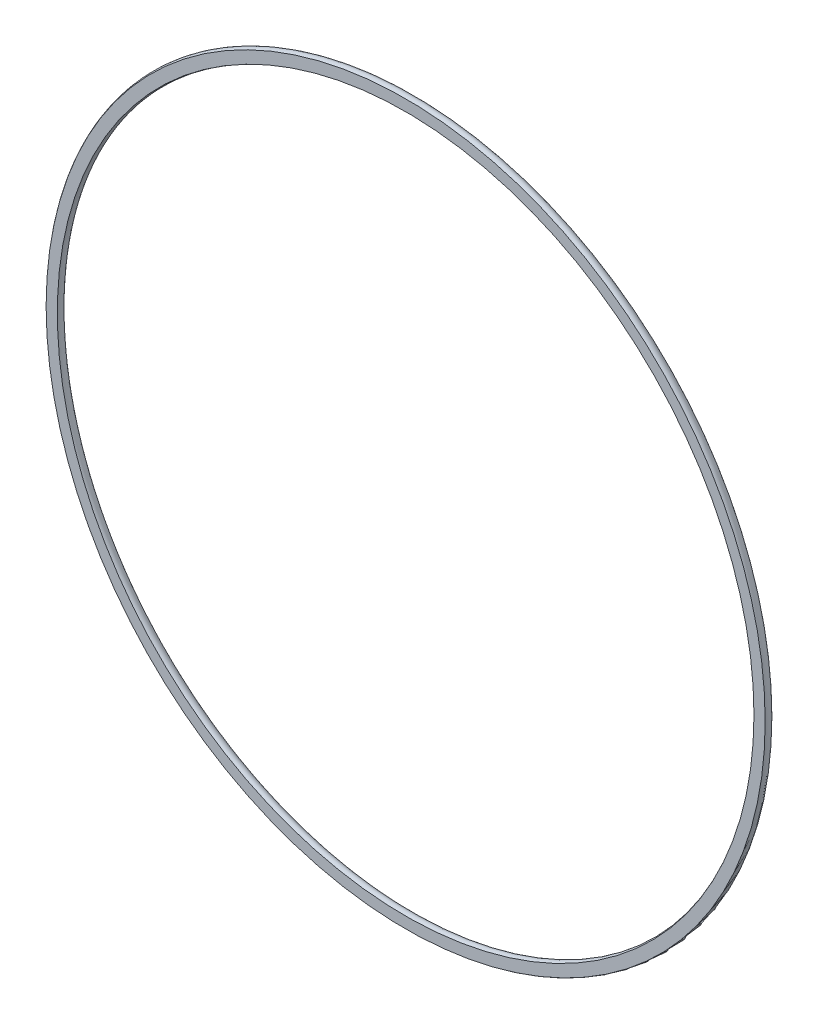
SolidWorks part; units mm, degrees
ref_plane "Front" through (0, 0, 0) normal (0, 0, 1) x (1, 0, 0)
ref_plane "Top" through (0, 0, 0) normal (0, 1, 0) x (1, 0, 0)
ref_plane "Right" through (0, 0, 0) normal (1, 0, 0) x (0, 0, -1)
sketch "Sketch1" plane through (0, 0, 0) normal (1, 0, 0) x (0, -1, 0)
  line L0 (0, -1.7653) -> (0, 1.7653) construction
  line L2 (-108.4351, 0) -> (108.4351, 0) construction
  line L3 (-95.0468, 0) -> (95.0468, 0) construction
  circle A0 centre (96.8121, 0) radius 1.7653
  point P9 (95.0468, 0)
  point P10 (98.5774, 0)
  point P13 (96.8121, 1.7653)
  point P14 (96.8121, -1.7653)
  dimension "Width" = 3.5306
  dimension "ID" = 190.0936
revolve "Revolve1" add sketch "Sketch1" angle 360 about L0
ref_plane "Plane1" through (0, 0, 1.7653) normal (0, 0, 1) x (1, 0, 0)
sketch "Sketch2" plane through (0, 0, 1.7653) normal (0, 0, 1) x (1, 0, 0)
  line L1 (-113.7254, -114.2549) -> (147.6179, -114.2549)
  line L2 (-113.7254, -114.2549) -> (-113.7254, 121.8013)
  line L3 (-113.7254, 121.8013) -> (147.6179, 121.8013)
  line L4 (147.6179, -114.2549) -> (147.6179, 121.8013)
extrude "Cut-Extrude1" cut sketch "Sketch2" against normal blind 0.889
